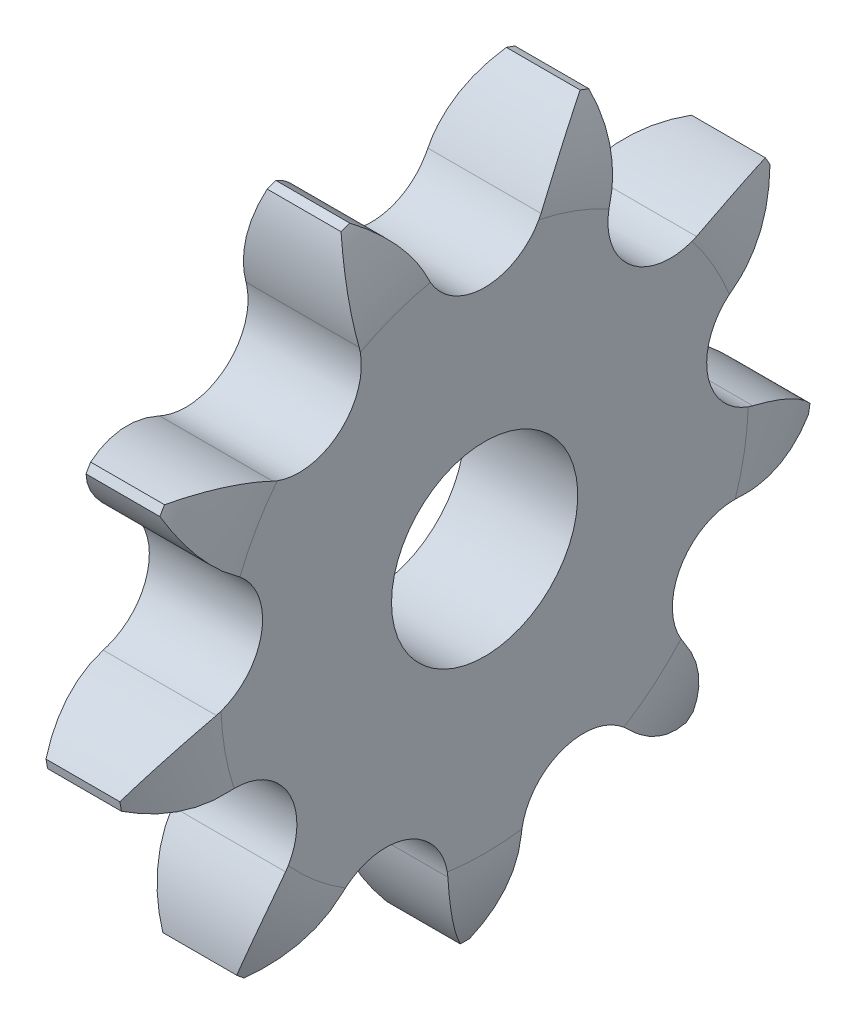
SolidWorks part; units mm, degrees
ref_plane "Plane1" through (0, 0, 0) normal (0, 0, 1) x (1, 0, 0)
ref_plane "Plane2" through (0, 0, 0) normal (0, 1, 0) x (1, 0, 0)
ref_plane "Plane3" through (0, 0, 0) normal (1, 0, 0) x (0, 0, -1)
sketch "Clipboard" plane through (0, 0, 0) normal (0, 1, 0) x (1, 0, 0)
  line L0 (0, 0) -> (12.5436, -1.9867)
  line L1 (-15, 0) -> (100, 0) construction
  line L2 (0, 0) -> (-0.8416, 0.9512)
  line L3 (0, 0) -> (-11.863, 4.5341)
  line L4 (0, 0) -> (3.0618, 0.4849)
  line L5 (0, 0) -> (-2.8109, -1.0484)
  line L6 (0, 0) -> (-6.0514, -4.0829)
  line L7 (-0.8416, 0.9512) -> (8.5146, 2.6009)
  line L8 (-76.2, 38.1) -> (-75.2, 38.1)
  line L9 (-73.4321, 41.7084) -> (-72.837, 41.7846)
  line L10 (-73.4741, 12.9512) -> (-59.0941, 12.9512)
  circle A0 centre (0, 0) radius 3.975
  circle A1 centre (0, 0) radius 10.0465
  circle A2 centre (0, 0) radius 25
sketch "BasProSke" plane through (0, 0, 0) normal (0, 1, 0) x (1, 0, 0)
  line L0 (-10, 0) -> (60, 0) construction
  line L1 (0, 0) -> (0, 16.9929)
  line L2 (0, 0) -> (7.3, 0)
  line L3 (7.3, 0) -> (7.3, 16.9929)
  line L4 (6.03, 22.5287) -> (1.27, 22.5287)
  arc A0 (0, 16.9929) -> (1.27, 22.5287) centre (12.7, 16.9929) cw
  arc A1 (7.3, 16.9929) -> (6.03, 22.5287) centre (-5.4, 16.9929) ccw
revolve "Base-Revolve" add sketch "BasProSke" angle 360 about L0
sketch "TooCutSke" plane through (0, 0, 0) normal (1, 0, 0) x (0, 0, -1)
  line L0 (0, 18.6059) -> (3.6386, 16.9092) construction
  line L1 (0, 0) -> (0, 107) construction
  line L2 (0, 18.6059) -> (-10, 18.6059) construction
  line L3 (0, 18.6059) -> (-3.6386, 16.9092) construction
  arc A0 (3.6386, 16.9092) -> (7.9748, 21.6037) centre (13.1494, 12.4742) cw
  arc A1 (3.6386, 16.9092) -> (-3.6386, 16.9092) centre (0, 18.6059) cw
  arc A2 (-3.6386, 16.9092) -> (-7.9748, 21.6037) centre (-13.1494, 12.4742) ccw
  arc A3 (7.9748, 21.6037) -> (-7.9748, 21.6037) centre (0, 0) ccw
extrude "ToothCut" cut sketch "TooCutSke" along normal through all
pattern_circular "TeethCuts" count 9 every 40 about axis through (-10, 0, 0) along (1, 0, 0) of "ToothCut"
sketch "HubNeaOneSke" plane through (0, 0, 0) normal (-1, 0, 0) x (0, 0, 1)
  circle A0 centre (0, 0) radius 10.0465
extrude "HubNearOne" [suppressed] add sketch "HubNeaOneSke" along normal blind 2.2005
fillet "HubNearOneFillet" [suppressed] radius 0.6
sketch "HubNeaBotSke" plane through (0, 0, 0) normal (-1, 0, 0) x (0, 0, 1)
  circle A0 centre (0, 0) radius 10.0465
extrude "HubNearBoth" [suppressed] add sketch "HubNeaBotSke" along normal blind 1.1003
fillet "HubNearBothFillet" [suppressed] radius 0.6
ref_plane "FarPln" through (7.3, 0, 0) normal (1, 0, 0) x (0, 0, -1)
sketch "HubFarSke" plane through (7.3, 0, 0) normal (1, 0, 0) x (0, 0, -1)
  circle A0 centre (0, 0) radius 10.0465
extrude "HubFar" [suppressed] add sketch "HubFarSke" along normal blind 1.1003
fillet "HubFarFillet" [suppressed] radius 0.6
sketch "BorSke" plane through (0, 0, 0) normal (1, 0, 0) x (0, 0, -1)
  circle A0 centre (0, 0) radius 6
extrude "Bore" cut sketch "BorSke" along normal mid plane 19.001
sketch "KeySke" plane through (0, 0, 0) normal (1, 0, 0) x (0, 0, -1)
  line L0 (-1, 0) -> (-1, 7)
  line L1 (-1, 7) -> (1, 7)
  line L2 (1, 7) -> (1, 0)
  line L3 (0, 0) -> (0, 34) construction
  line L4 (-1, 0) -> (1, 0)
extrude "Keyway" [suppressed] cut sketch "KeySke" along normal mid plane 19.001
pattern_circular "Keyway2" [suppressed] count 2 every 90 about axis through (-10, 0, 0) along (1, 0, 0)
equation "\"Num_teethClipboard_v1\" =  int( \"Num_teeth@Clipboard\" )"
equation "\"Num_teethClipboard_v2\" =  ((sgn( \"Num_teethClipboard_v1\" - 5.0)+1)*( \"Num_teethClipboard_v1\" - 5.0))/2 +5.0"
equation "\"Num_teeth@Clipboard\" =  ((sgn( \"Num_teethClipboard_v2\" - 200.0)-1)*( \"Num_teethClipboard_v2\" - 200.0))/-2 +200.0"
equation "\"MHDClipboard_v1\" =  \"Pitch@Clipboard\" * (1.0 / tan(3.14159265 / \"Num_teeth@Clipboard\" )) - 1.05 * \"Plate_wid@Clipboard\" - 2.0 * \"Fillet_rad@Clipboard\" - 1.0"
equation "\"Thickness@Clipboard\" =  \"Face_width@Clipboard\" + (\"Num_strands@Clipboard\" - 1) * \"Transv_pitch@Clipboard\""
equation "\"OALClipboard_v1\" =  \"Thickness@Clipboard\" + 2 * \"Fillet_rad@Clipboard\" + 1"
equation "\"MHD@Clipboard\" =  ((sgn( \"MHDClipboard_v1\" - \"Hub_dia@Clipboard\" )-1)*( \"MHDClipboard_v1\" - \"Hub_dia@Clipboard\" ))/-2+ \"Hub_dia@Clipboard\""
equation "\"OAL@Clipboard\" =  ((sgn( \"OALClipboard_v1\" - \"Overall_len@Clipboard\" )+1)*( \"OALClipboard_v1\" - \"Overall_len@Clipboard\" ))/2 + \"Overall_len@Clipboard\" + 0.0005"
equation "\"Num_teethTeethCuts_v1\" =  int( \"Show_teeth@Clipboard\" ) + 1"
equation "\"Num_teethTeethCuts_v2\" =  ((sgn( \"Num_teethTeethCuts_v1\" - \"Num_teeth@Clipboard\" )-1)*( \"Num_teethTeethCuts_v1\" - \"Num_teeth@Clipboard\" ))/-2+ \"Num_teeth@Clipboard\""
equation "\"Num_teeth@TeethCuts\" =  ((sgn( \"Num_teethTeethCuts_v2\" - 2.0)+1)*( \"Num_teethTeethCuts_v2\" - 2.0))/2 +2.0"
equation "\"Angle@TeethCuts\" =  360.0 / \"Num_teeth@Clipboard\""
equation "\"Seat_radius@TooCutSke\" =  ( \"Pitch@Clipboard\" / 2.0) / sin(3.14159265 / \"Num_teeth@Clipboard\" ) - \"Dr@Clipboard\" / 2.0 + \"Dr@Clipboard\" * 0.505"
equation "\"R1@TooCutSke\" =  \"Dr@Clipboard\" * 0.505"
equation "\"X@TooCutSke\" =  140.0 - (90.0 / \"Num_teeth@Clipboard\")"
equation "\"R2@TooCutSke\" =  0.12 * \"Dr@Clipboard\" * ( \"Num_teeth@Clipboard\" + 2.0)"
equation "\"Overcut@TooCutSke\" =  0.5 + 0.625 * \"Pitch@Clipboard\" - 0.5 * \"Dr@Clipboard\"  +  \"Pitch@Clipboard\" / 2.0 / sin(3.14159265 / \"Num_teeth@Clipboard\" )"
equation "\"Diameter@BasProSke\" =  2.0 * ( 0.625 * \"Pitch@Clipboard\" - 0.5 * \"Dr@Clipboard\"  +  \"Pitch@Clipboard\" / 2.0 / sin(3.14159265 / \"Num_teeth@Clipboard\" ))"
equation "\"Thickness@BasProSke\" =  \"Thickness@Clipboard\""
equation "\"G1@BasProSke\" =  \"Side_relief@Clipboard\""
equation "\"G2@BasProSke\" =  \"Side_relief@Clipboard\""
equation "\"D1@BasProSke\" =  \"Side_radius@Clipboard\""
equation "\"Diameter@HubNeaOneSke\" =  \"MHD@Clipboard\""
equation "\"Length@HubNearOne\" =  \"OAL@Clipboard\" - \"Thickness@BasProSke\""
equation "\"Diameter@HubNeaBotSke\" =  \"MHD@Clipboard\""
equation "\"Length@HubNearBoth\" =  ( \"OAL@Clipboard\" - \"Thickness@BasProSke\" ) / 2.0"
equation "\"D1@HubNearOneFillet\" =  \"Fillet_rad@Clipboard\""
equation "\"D1@HubNearBothFillet\" =  \"Fillet_rad@Clipboard\""
equation "\"Thickness@FarPln\" =  \"Thickness@BasProSke\""
equation "\"Diameter@HubFarSke\" =  \"MHD@Clipboard\""
equation "\"Length@HubFar\" =  ( \"OAL@Clipboard\" - \"Thickness@BasProSke\" ) / 2.0"
equation "\"D1@HubFarFillet\" =  \"Fillet_rad@Clipboard\""
equation "\"D1@Bore\" =  \"OAL@Clipboard\" * 2.0"
equation "\"D1@Keyway\" =  \"OAL@Clipboard\" * 2.0"
equation "\"Offset@KeySke\" =  \"T_dim@Clipboard\" + \"Diameter@BorSke\" / 2.0"
